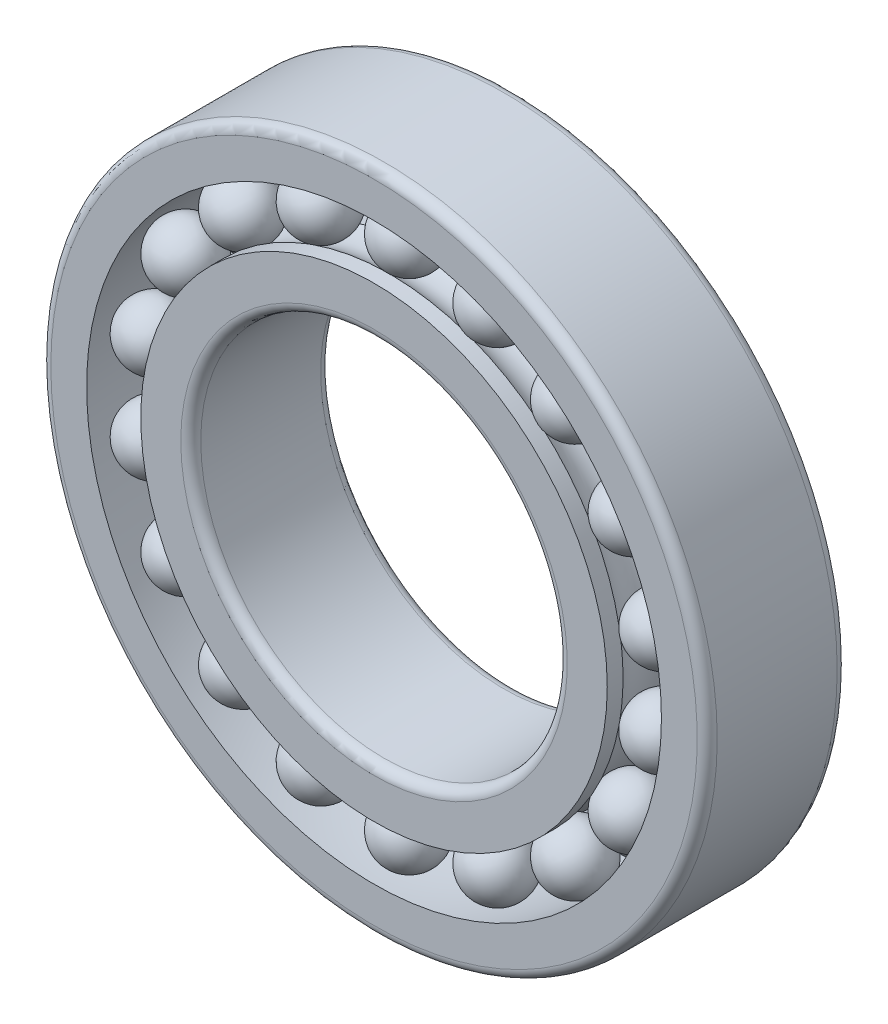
SolidWorks part; units mm, degrees
ref_plane "Front Plane" through (0, 0, 0) normal (0, 0, 1) x (1, 0, 0)
ref_plane "Top Plane" through (0, 0, 0) normal (0, 1, 0) x (1, 0, 0)
ref_plane "Right Plane" through (0, 0, 0) normal (1, 0, 0) x (0, 0, -1)
other "Configuration Table"
sketch "BaseSke" plane through (0, 0, 0) normal (1, 0, 0) x (0, 0, -1)
  line L0 (-47.2296, 0) -> (24.6132, 0) construction
  line L1 (-47.2296, 38.75) -> (24.6132, 38.75) construction
  line L2 (0, 129.5214) -> (0, -86.3012) construction
  line L3 (-5.2023, 43.5227) -> (-5.2023, 33.9773)
  line L4 (-10.5, 50) -> (10.5, 50) construction
  line L5 (-10.5, 27.5) -> (10.5, 27.5) construction
  line L6 (-10.5, 50) -> (-10.5, 27.5) construction
  line L7 (10.5, 50) -> (10.5, 27.5) construction
  line L8 (-9.975, 50) -> (-9.975, 27.5) construction
  arc A0 (-5.2023, 43.5227) -> (-5.2023, 33.9773) centre (-5.2023, 38.75) ccw
revolve "Ball" add sketch "BaseSke" angle 360 about L3
sketch "OuterRaceSke" plane through (0, 0, 0) normal (1, 0, 0) x (0, 0, -1)
  line L0 (0, 0) -> (0, 87.5396) construction
  line L1 (-10.5, 50) -> (10.5, 50)
  line L2 (-10.5, 50) -> (-10.5, 43.1291)
  line L4 (10.5, 50) -> (10.5, 43.1291)
  line L5 (-50.3916, 0) -> (55.2197, 0) construction
  arc A0 (-10.5, 43.1291) -> (10.5, 43.1291) centre (0, -66.3686) cw
  arc A1 (-10.5, 43.1492) -> (10.5, 43.1492) centre (0, -66.3686) cw construction
  arc A3 (-5.2023, 43.5227) -> (-5.2023, 33.9773) centre (-5.2023, 38.75) ccw construction
revolve "OuterRace" add sketch "OuterRaceSke" angle 360 about L5
mirror "MirrorBall" about plane through (0, 0, 0) normal (0, 0, 1) of "Ball"
sketch "InnerRaceSke" plane through (0, 0, 0) normal (1, 0, 0) x (0, 0, -1)
  line L0 (-70.8626, 0) -> (113.5527, 0) construction
  line L1 (0, 58.441) -> (0, -70.8113) construction
  line L2 (-10.5, 27.5) -> (10.5, 27.5)
  line L3 (-10.5, 27.5) -> (-10.5, 35)
  line L4 (-10.5, 35) -> (-8.1384, 35)
  line L5 (10.5, 27.5) -> (10.5, 35)
  line L6 (0, 129.5214) -> (0, -86.3012) construction
  line L7 (-2.2661, 35) -> (2.2661, 35)
  line L8 (10.5, 35) -> (8.1384, 35)
  arc A0 (-8.1384, 35) -> (-2.2661, 35) centre (-5.2023, 38.75) ccw
  circle A1 centre (-5.2023, 38.75) radius 4.7727 construction
  arc A2 (8.1384, 35) -> (2.2661, 35) centre (5.2023, 38.75) cw
  point P17 (0, 27.5)
  point P23 (0, 35)
revolve "InnerRace" add sketch "InnerRaceSke" angle 360 about L0
fillet "Fillet1" radius 1.5 4 edges at (27.5, 0, -10.5) (27.5, 0, 10.5) (50, 0, -10.5) (50, 0, 10.5)
pattern_circular "CirPatternBall" count 18 over 360 about axis through (0, 0, 0) along (0, 0, 1) of "Ball", "MirrorBall"
sketch "TaperSke" plane through (0, 0, 0) normal (1, 0, 0) x (0, 0, -1)
  line L0 (-10.5, 27.5) -> (10.5, 27.5)
  line L1 (10.5, 27.5) -> (10.5, 29.25)
  line L2 (10.5, 29.25) -> (-10.5, 27.5)
  line L7 (-41.2502, 0) -> (40.8606, 0) construction
revolve "Taper" [suppressed] cut sketch "TaperSke" angle 360 about L7
fillet "Fillet2" [suppressed] radius 1.5
sketch "SimplifiedSke" plane through (0, 0, 0) normal (1, 0, 0) x (0, 0, -1)
  line L0 (37.5911, 0) -> (-37.5911, 0) construction
  line L1 (0, 0) -> (0, 72.9012) construction
  circle A0 centre (-5.2023, 38.75) radius 4.7727
  circle A1 centre (-5.2023, 38.75) radius 4.7727 construction
  circle A2 centre (5.2023, 38.75) radius 4.7727
revolve "Simplified" [suppressed] add sketch "SimplifiedSke" angle 360 about L0
equation "\"D1@BaseSke\" =  (\"Bearing_Outside_Diameter@BaseSke\"  +  \"Bearing_Inside_Diameter@BaseSke\"  )  / 4"
equation "\"Ball_diameter@BaseSke\" = \"Bearing_Thickness@BaseSke\" / 2.2"
equation "\"D1@InnerRaceSke\" = \"Bearing_Inside_Diameter@BaseSke\" +  ( \"Bearing_Outside_Diameter@BaseSke\" - \"Bearing_Inside_Diameter@BaseSke\" )  / 3"
equation "\"D1@CirPatternBall\" = int( \"D1@BaseSke\"* pi  * 2 / \"Ball_diameter@BaseSke\" /1.4)"
equation "\"Taper@TaperSke\" = \"Bearing_Thickness@BaseSke\"/12"
equation "\"D1@Fillet2\" = \"Fillet_radius@Fillet1\""
equation "\"D2@InnerRaceSke\" = \"Ball_diameter@BaseSke\"-0.02"
equation "\"D1@OuterRaceSke\" = \"Bearing_Inside_Diameter@BaseSke\"*2"
equation "\"D2@BaseSke\" = \"Bearing_Thickness@BaseSke\"/40"
